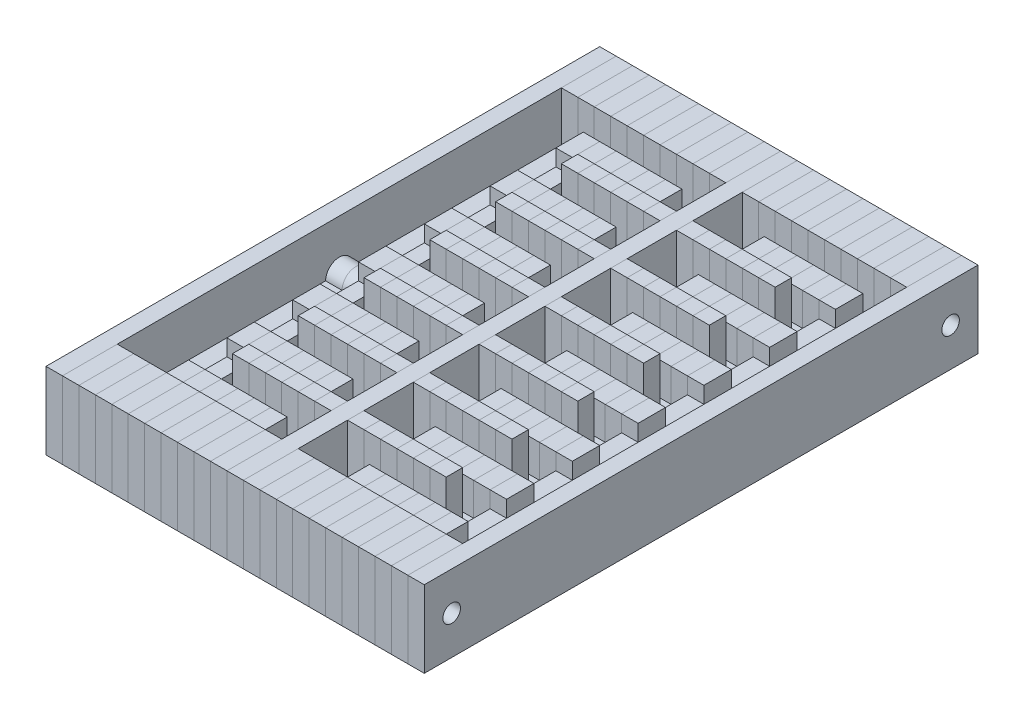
SolidWorks part; units mm, degrees
ref_plane "Front" through (0, 0, 0) normal (0, 0, 1) x (1, 0, 0)
ref_plane "Top" through (0, 0, 0) normal (0, 1, 0) x (1, 0, 0)
ref_plane "Right" through (0, 0, 0) normal (1, 0, 0) x (0, 0, -1)
sketch "Sketch1" plane through (0, 0, 0) normal (0, 1, 0) x (1, 0, 0)
  line L0 (-34.5, -50.5) -> (34.5, 50.5) construction
  line L1 (-34.5, -50.5) -> (34.5, -50.5)
  line L2 (-34.5, -50.5) -> (-34.5, 50.5)
  line L3 (-34.5, 50.5) -> (34.5, 50.5)
  line L4 (34.5, -50.5) -> (34.5, 50.5)
  dimension "D1" = 101
  dimension "D2" = 69
extrude "Boss-Extrude1" add sketch "Sketch1" along normal blind 14
sketch "Sketch2" plane through (34.5, 0, 0) normal (1, 0, 0) x (0, 0, -1)
  line L0 (-50.5, 7) -> (50.5, 7) construction
  line L1 (-50.5, 14) -> (-50.5, 0) construction
  line L2 (50.5, 14) -> (50.5, 0) construction
  circle A0 centre (-45.5, 7) radius 1.6
  circle A1 centre (45.5, 7) radius 1.6
  dimension "D1" = 3.2
  dimension "D2" = 5
  dimension "D3" = 5
extrude "Cut-Extrude1" cut sketch "Sketch2" against normal through all
other "Cavity1"
other "finger-bottom<1>@mold1"
other "finger-top<1>@mold1"
fillet "Fillet1" [suppressed] radius 1
sketch "Sketch3" plane through (0, 0, 50.5) normal (0, 0, 1) x (1, 0, 0)
  line L0 (-31.5, 24.4814) -> (-31.5, -12.0941)
  line L2 (-28.5, 24.4814) -> (-28.5, -12.0941)
  line L3 (-25.5, 24.4814) -> (-25.5, -12.0941)
  line L4 (-22.5, 24.4814) -> (-22.5, -12.0941)
  line L5 (-19.5, 24.4814) -> (-19.5, -12.0941)
  line L6 (-16.5, 24.4814) -> (-16.5, -12.0941)
  line L7 (-13.5, 24.4814) -> (-13.5, -12.0941)
  line L8 (-10.5, 24.4814) -> (-10.5, -12.0941)
  line L9 (-7.5, 24.4814) -> (-7.5, -12.0941)
  line L10 (-4.5, 24.4814) -> (-4.5, -12.0941)
  line L11 (-1.5, 24.4814) -> (-1.5, -12.0941)
  line L12 (1.5, 24.4814) -> (1.5, -12.0941)
  line L13 (4.5, 24.4814) -> (4.5, -12.0941)
  line L14 (7.5, 24.4814) -> (7.5, -12.0941)
  line L15 (10.5, 24.4814) -> (10.5, -12.0941)
  line L16 (13.5, 24.4814) -> (13.5, -12.0941)
  line L17 (16.5, 24.4814) -> (16.5, -12.0941)
  line L18 (19.5, 24.4814) -> (19.5, -12.0941)
  line L19 (22.5, 24.4814) -> (22.5, -12.0941)
  line L20 (25.5, 24.4814) -> (25.5, -12.0941)
  line L21 (28.5, 24.4814) -> (28.5, -12.0941)
  line L22 (31.5, 24.4814) -> (31.5, -12.0941)
  line L24 (-34.5, 14) -> (-34.5, 0) construction
  dimension "D2" = 3
  dimension "D3" = 3
  dimension "D1" = 22
split "Split1" trim tools "Sketch3" bodies to split 102 resulting bodies 106 107 108 109 110 111 112 113 114 115 116 118 119 120 121 122 123 124 126 127 128 130 131
